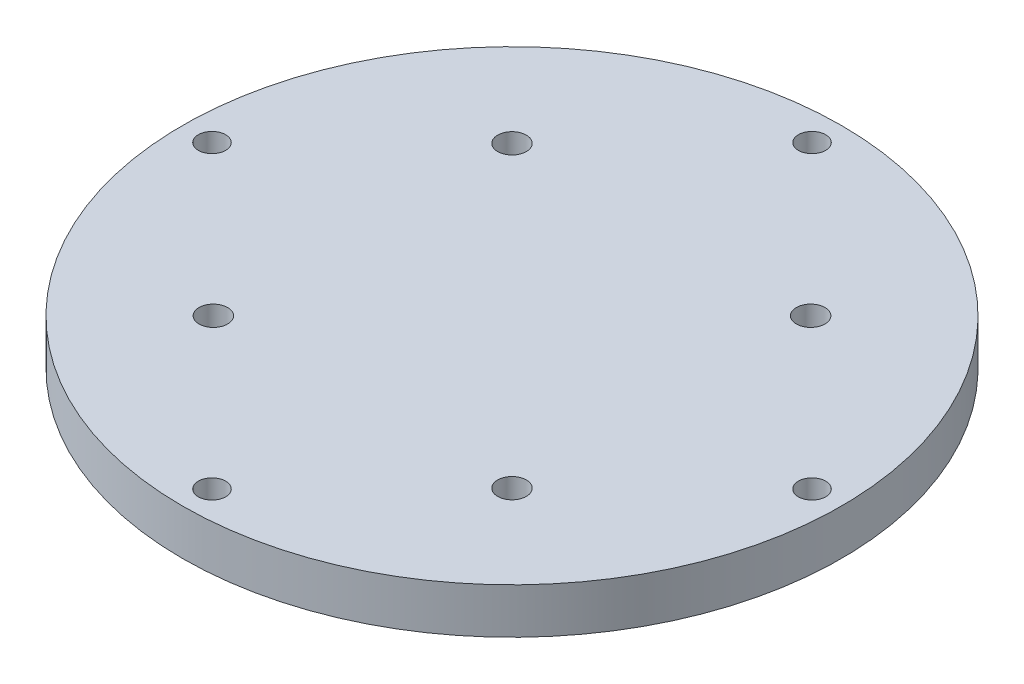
SolidWorks part; units mm, degrees
ref_plane "Front Plane" through (0, 0, 0) normal (0, 0, 1) x (1, 0, 0)
ref_plane "Top Plane" through (0, 0, 0) normal (0, 1, 0) x (1, 0, 0)
ref_plane "Right Plane" through (0, 0, 0) normal (1, 0, 0) x (0, 0, -1)
sketch "Sketch1" plane through (0, 0, 0) normal (0, 1, 0) x (1, 0, 0)
  circle A0 centre (0, 0) radius 46.0375
  circle A1 centre (0, 41.91) radius 1.905
  circle A2 centre (41.91, 0) radius 1.905
  circle A3 centre (0, -41.91) radius 1.905
  circle A4 centre (-41.91, 0) radius 1.905
  circle A5 centre (-20.8597, 20.8597) radius 2
  circle A6 centre (20.8597, 20.8597) radius 2
  circle A7 centre (20.8597, -20.8597) radius 2
  circle A8 centre (-20.8597, -20.8597) radius 2
  point P14 (0, 0)
  point P23 (0, 0)
  dimension "D1" = 92.075
  dimension "D2" = 3.81
  dimension "D5" = 4
  dimension "D3" = 41.91
  dimension "D6" = 45
  dimension "D7" = 29.5
  dimension "D4" = 4
  dimension "D8" = 4
extrude "Boss-Extrude1" add sketch "Sketch1" along normal blind 6.35
